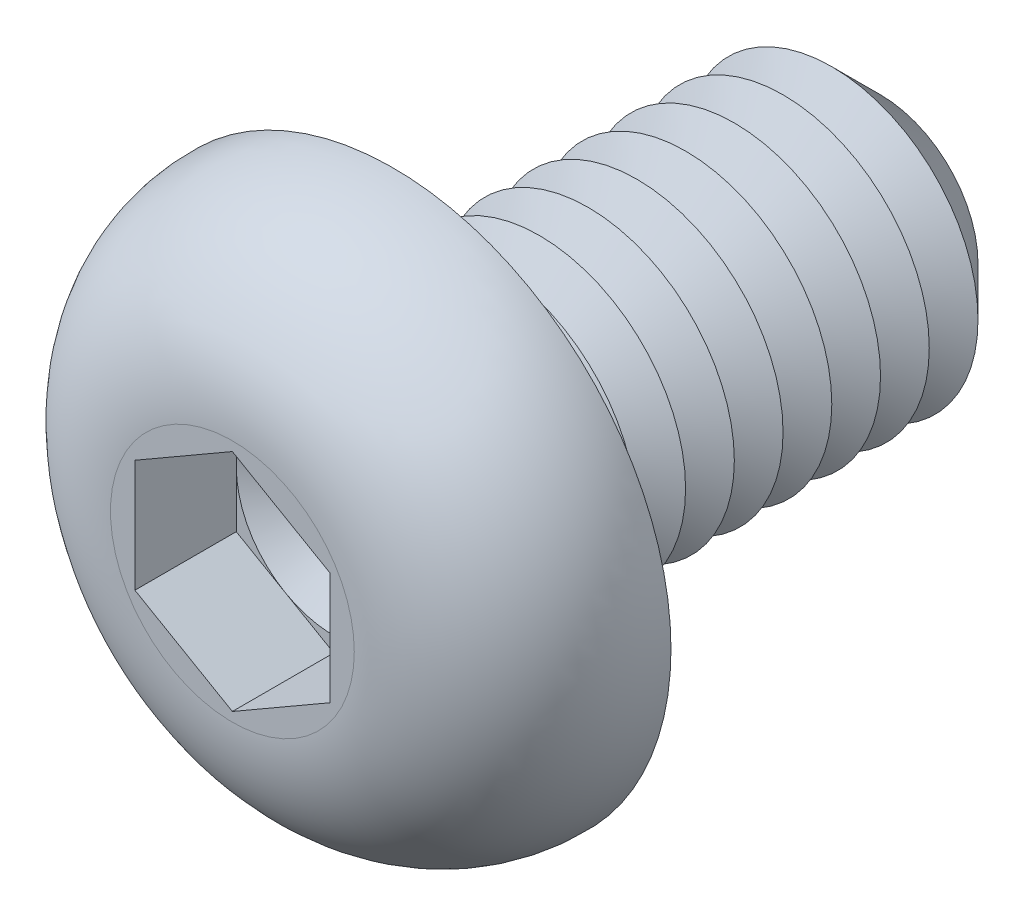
SolidWorks part; units mm, degrees
ref_plane "Front Plane" through (0, 0, 0) normal (0, 0, 1) x (1, 0, 0)
ref_plane "Top Plane" through (0, 0, 0) normal (0, 1, 0) x (1, 0, 0)
ref_plane "Right Plane" through (0, 0, 0) normal (1, 0, 0) x (0, 0, -1)
sketch "Sketch1" plane through (0, 0, 0) normal (1, 0, 0) x (0, 0, -1)
  line L0 (-47.9342, 0) -> (60.3146, 0) construction
sketch "Sketch2" plane through (0, 0, 0) normal (1, 0, 0) x (0, 0, -1)
  line L0 (0, 0) -> (-1.65, 0)
  line L1 (-47.9342, 0) -> (60.3146, 0) construction
  line L2 (-1.65, 0) -> (-1.65, 1.2508)
  line L3 (0, 2.85) -> (0, 0)
  arc A0 (-1.65, 1.2508) -> (0, 2.85) centre (-0.05, 1.2508) cw
  dimension "D1" = 1.6
  dimension "D2" = 1.65
  dimension "D3" = 2.85
revolve "Revolve1" add sketch "Sketch2" angle 360 about L0
sketch "Sketch3" plane through (0, 0, 1.65) normal (0, 0, 1) x (1, 0, 0)
  line L1 (0, 1.1547) -> (-1, 0.5774)
  line L2 (-1, 0.5774) -> (-1, -0.5774)
  line L3 (-1, -0.5774) -> (0, -1.1547)
  line L4 (0, -1.1547) -> (1, -0.5774)
  line L5 (1, -0.5774) -> (1, 0.5774)
  line L6 (1, 0.5774) -> (0, 1.1547)
  circle A0 centre (0, 0) radius 1 construction
  dimension "D1" = 2
extrude "Cut-Extrude1" cut sketch "Sketch3" against normal blind 1.04
sketch "Sketch4" plane through (0, 0, 0) normal (0, 0, -1) x (-1, 0, 0)
  circle A0 centre (0, 0) radius 1.5
  dimension "D1" = 3
extrude "Boss-Extrude1" add sketch "Sketch4" along normal blind 5
chamfer "Chamfer1" distance 0.5 angle 45 1 edges at (-1.5, 0, -5)
sketch "Sketch5" plane through (0, 0, 0) normal (1, 0, 0) x (0, 0, -1)
  line L0 (0.5, 1.5) -> (1, 1.5)
  line L1 (4.5, 1.5) -> (0, 1.5) construction
  line L2 (1, 1.5) -> (0.75, 1.067)
  line L3 (0.75, 1.067) -> (0.5, 1.5)
  line L4 (0, -2.85) -> (0, 2.85) construction
  line L5 (4.5, 1.5) -> (0, 1.5) construction
  dimension "D1" = 0.5
  dimension "D2" = 0.5
revolve "Cut-Revolve1" cut sketch "Sketch5" angle 360 about L0
pattern_linear "LPattern1" count 8 spacing 0.5 along (0, 0, -1) of "Cut-Revolve1"
fillet "Fillet2" radius 0.2 1 edges at (1.5, 0, 0)
sketch "Sketch6" plane through (0, 0, 0.61) normal (0, 0, 1) x (1, 0, 0)
  line L0 (0, -1.1547) -> (1, -0.5774) construction
  circle A0 centre (0, 0) radius 1
extrude "Cut-Extrude2" cut sketch "Sketch6" against normal through all draft 60
